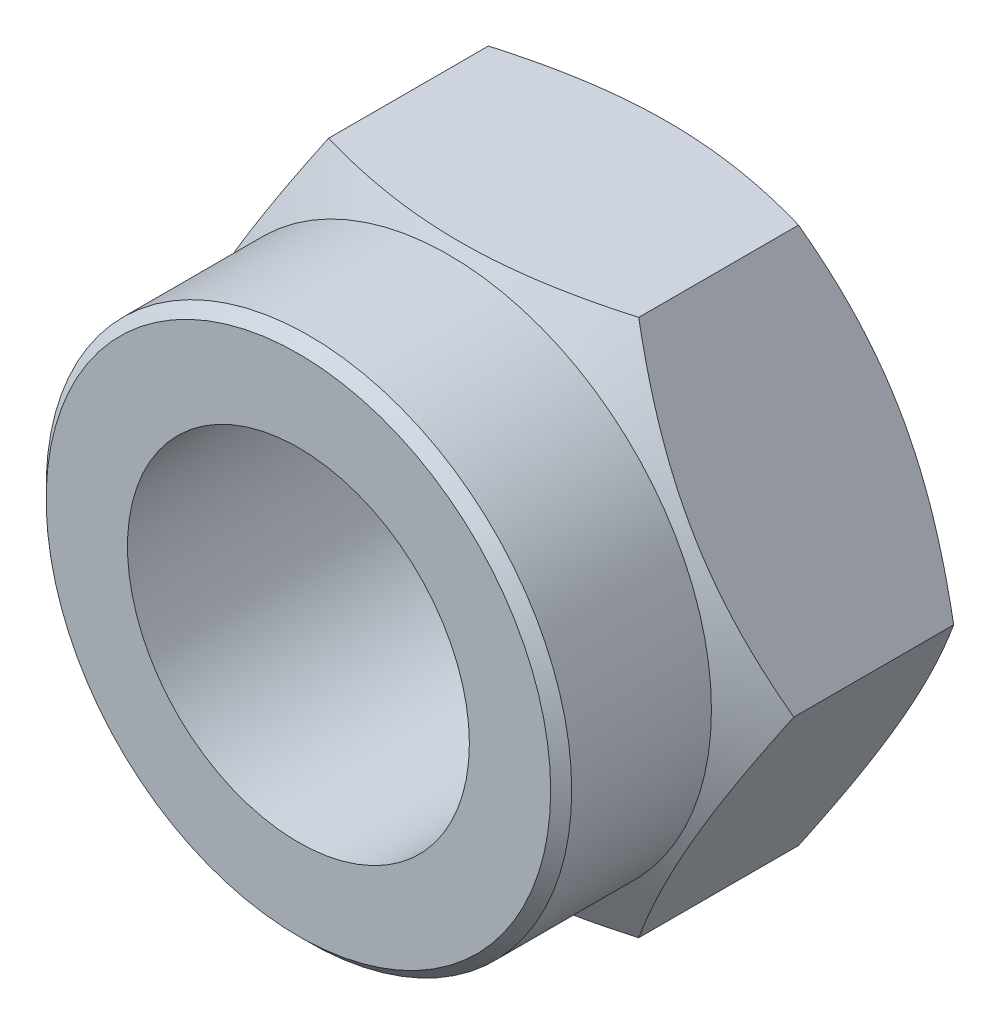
SolidWorks part; units mm, degrees
ref_plane "Front" through (0, 0, 0) normal (0, 0, 1) x (1, 0, 0)
ref_plane "Top" through (0, 0, 0) normal (0, 1, 0) x (1, 0, 0)
ref_plane "Right" through (0, 0, 0) normal (1, 0, 0) x (0, 0, -1)
other "Configuration Table"
sketch "Sketch1" plane through (0, 0, 0) normal (0, 0, 1) x (1, 0, 0)
  line L1 (15.8771, -27.5) -> (31.7543, 0)
  line L2 (31.7543, 0) -> (15.8771, 27.5)
  line L3 (15.8771, 27.5) -> (-15.8771, 27.5)
  line L4 (-15.8771, 27.5) -> (-31.7543, 0)
  line L5 (-31.7543, 0) -> (-15.8771, -27.5)
  line L6 (-15.8771, -27.5) -> (15.8771, -27.5)
  circle A0 centre (0, 0) radius 27.5 construction
  circle A1 centre (0, 0) radius 17.5
extrude "BaseNut" add sketch "Sketch1" against normal blind 23.52
sketch "Sketch3" plane through (0, 0, 0) normal (0, 1, 0) x (1, 0, 0)
  line L0 (0, 16.3108) -> (0, -16.1137) construction
  line L2 (-2.0696, 11.76) -> (33.5085, 11.76) construction
  line L3 (25.555, 23.52) -> (31.7543, 23.52)
  line L5 (31.7543, 23.52) -> (31.7543, 19.9409)
  line L7 (31.7543, 19.9409) -> (25.555, 23.52)
  line L8 (31.7543, 3.5791) -> (25.555, 0)
  line L9 (31.7543, 0) -> (31.7543, 3.5791)
  line L10 (25.555, 0) -> (31.7543, 0)
  dimension "D1" = 30
  dimension "dw" = 51.11
revolve "Double-Chamfer" cut sketch "Sketch3" angle 360 about L0
sketch "Sketch2" plane through (20.0871, -4.2815, 0) normal (0, 0, 1) x (1, 0, 0)
  circle A1 centre (-20.0871, 4.2815) radius 17.5 construction
  circle A2 centre (-20.0871, 4.2815) radius 26.9
  circle A3 centre (-20.0871, 4.2815) radius 17.5
extrude "Extrude1" add sketch "Sketch2" along normal offset from surface (15.38 mm away) 38.9
sketch "Sketch5" plane through (0, 0, 0) normal (0, 1, 0) x (1, 0, 0)
  line L0 (0, 16.8008) -> (0, -2.8116) construction
  line L2 (17.5, 23.52) -> (19.45, 23.52)
  line L5 (19.45, 23.52) -> (17.5, 21.57)
  line L7 (17.5, 21.57) -> (17.5, 23.52)
  dimension "D1" = 45
  dimension "da" = 38.9
revolve "EndChamfer" cut sketch "Sketch5" angle 360 about L0
chamfer "Chamfer1" distance 1.076 angle 45 1 edges at (26.9, 0, 15.38)
sketch "Sketch6" plane through (0, 0, 0) normal (0, 1, 0) x (1, 0, 0)
  line L0 (0, 30.0005) -> (0, -32.7386) construction
  line L1 (16, 22.32) -> (17.5, 22.32)
  line L2 (17.5, 22.32) -> (18.799, 21.57)
  line L3 (18.799, 21.57) -> (17.5, 20.82)
  line L4 (17.5, 20.82) -> (16, 20.82)
  line L5 (16, 20.82) -> (16, 22.32)
  line L6 (-17.5, 21.57) -> (17.5, 21.57) construction
revolve "Cut-Revolve10" [suppressed] cut sketch "Sketch6" angle 360 about L0
pattern_linear "LPattern10" [suppressed] count 13 spacing 1.8 along (0, 0, 1)
equation "\"D1@Chamfer1\" = \"s1@Sketch2\" / 50"
equation "\"D2@Sketch6\" = \"xd@Sketch1\""
equation "\"D1@Sketch6\" = (  \"D2@ThreadCosmetic1\" - \"xd@Sketch1\" )  / 2"
equation "\"D3@LPattern10\" = \"D1@Sketch6\" * 1.2"
equation "\"D1@LPattern10\" = \"m1@BaseNut\" / \"D3@LPattern10\""
